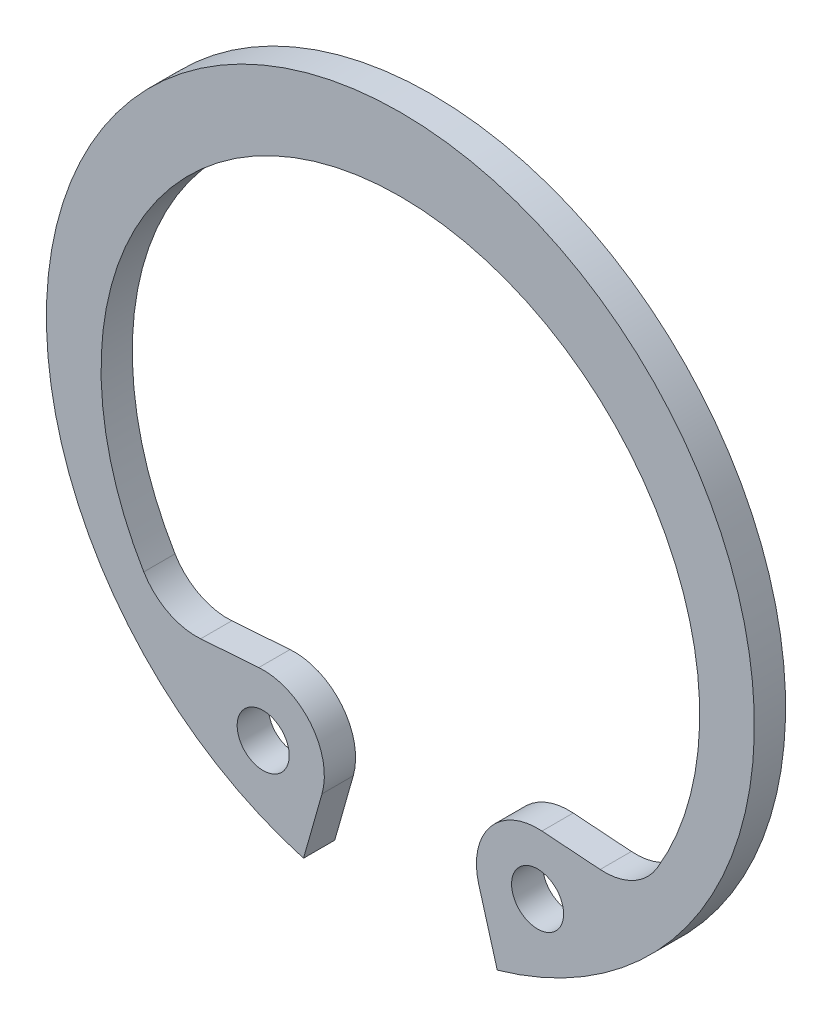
SolidWorks part; units mm, degrees
ref_plane "Face" through (0, 0, 0) normal (0, 0, 1) x (1, 0, 0)
ref_plane "Dessus" through (0, 0, 0) normal (0, 1, 0) x (1, 0, 0)
ref_plane "Droite" through (0, 0, 0) normal (1, 0, 0) x (0, 0, -1)
sketch "Esquisse1" plane through (0, 0, 0) normal (0, 0, 1) x (1, 0, 0)
  line L0 (0, 10.8) -> (0, 13.6) construction
  line L1 (3.0108, -10.5818) -> (3.7218, -13.0808)
  line L2 (4.17, -7.8626) -> (6.3722, -12.0148) construction
  line L3 (7.6748, -7.7557) -> (5.4398, -7.5948)
  line L4 (-7.6748, -7.7557) -> (-5.4398, -7.5948)
  line L5 (-3.0108, -10.5818) -> (-3.7218, -13.0808)
  line L6 (3.8826, -10.6672) -> (4.7712, -13.1087) construction
  line L7 (-3.8826, -10.6672) -> (-4.7712, -13.1087) construction
  arc A0 (3.7218, -13.0808) -> (-3.7218, -13.0808) centre (0, 0) ccw
  arc A1 (9.8581, -6.6219) -> (-9.8581, -6.6219) centre (0, -0.7) ccw
  arc A2 (5.4398, -7.5948) -> (3.0108, -10.5818) centre (5.2711, -9.9387) ccw
  arc A3 (7.6748, -7.7557) -> (9.8581, -6.6219) centre (7.8436, -5.4118) ccw
  circle A4 centre (5.2711, -9.9387) radius 1
  arc A5 (-7.6748, -7.7557) -> (-9.8581, -6.6219) centre (-7.8436, -5.4118) cw
  circle A6 centre (-5.2711, -9.9387) radius 1
  arc A7 (-5.4398, -7.5948) -> (-3.0108, -10.5818) centre (-5.2711, -9.9387) cw
  arc A8 (4.7712, -13.1087) -> (-4.7712, -13.1087) centre (0, 0) ccw construction
  circle A9 centre (0, 0) radius 13 construction
  dimension "dgorge" = 27.2
  dimension "D3" = 0.7
  dimension "dtrou" = 2
  dimension "dext" = 27.9
  dimension "dn" = 26
  dimension "b" = 2.8
  dimension "a" = 4.7
  dimension "D5" = 70
  dimension "D7" = 31.765
  dimension "D9" = 40
extrude "Base-Extrusion" add sketch "Esquisse1" along normal blind 1.2
equation "\"D3@Esquisse1\" = \"b@Esquisse1\"/4"
equation "\"D7@Esquisse1\" = 360-(360-\"D9@Esquisse1\")*\"dext@Esquisse1\"/\"dgorge@Esquisse1\""
